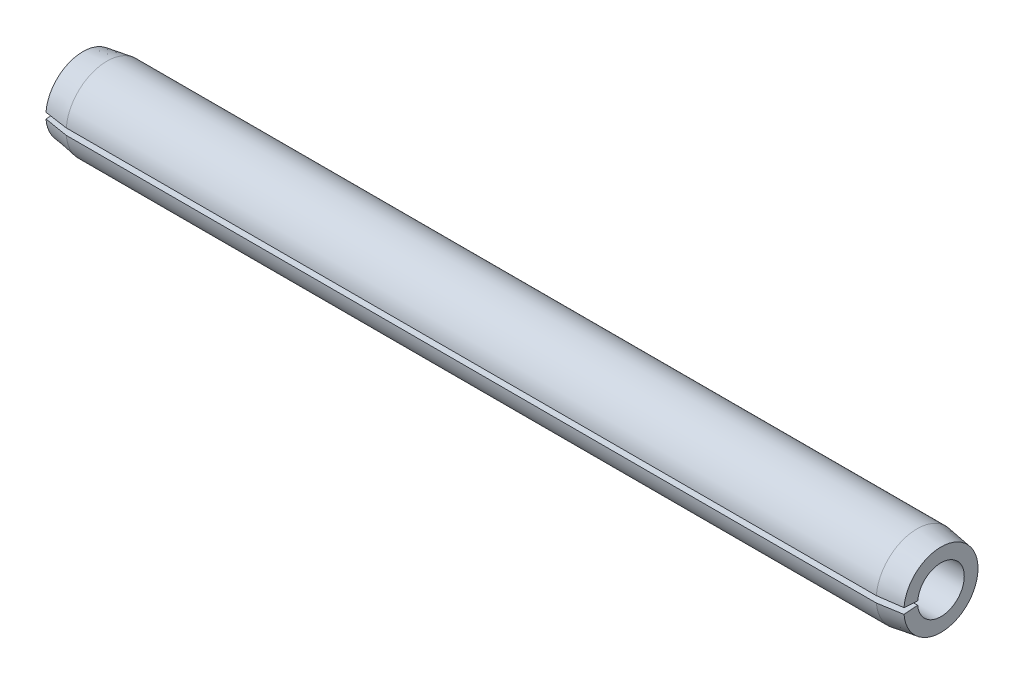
SolidWorks part; units mm, degrees
ref_plane "Plane1" through (0, 0, 0) normal (0, 0, 1) x (1, 0, 0)
ref_plane "Plane2" through (0, 0, 0) normal (0, 1, 0) x (1, 0, 0)
ref_plane "Plane3" through (0, 0, 0) normal (1, 0, 0) x (0, 0, -1)
sketch "Sketch1" plane through (0, 0, 0) normal (0, 0, 1) x (1, 0, 0)
  line L0 (-9.525, 0) -> (111.125, 0) construction
  line L1 (0, 1.3589) -> (50, 1.3589)
  line L2 (50, 1.3589) -> (50, 2.159)
  line L3 (50, 2.159) -> (48.603, 2.3749)
  line L4 (48.603, 2.3749) -> (1.397, 2.3749)
  line L5 (1.397, 2.3749) -> (0, 2.159)
  line L7 (0, 2.159) -> (0, 1.3589)
  dimension "Diameter" = 4.7498
  dimension "Length" = 50
  dimension "Thickness" = 1.016
  dimension "Top_ch_len" = 1.397
  dimension "Bottom_ch_len" = 1.397
  dimension "Bottom_ch_dia" = 4.318
  dimension "Top_ch_dia" = 4.318
revolve "Base-Revolve" add sketch "Sketch1" angle 360 about L0
sketch "Sketch2" plane through (0, 0, 0) normal (-1, 0, 0) x (0, -1, 0)
  line L0 (0, 0) -> (0.1901, 2.4149)
  line L1 (0, -3.175) -> (0, 12.7) construction
  line L2 (0, 0) -> (-0.1901, 2.4149)
  arc A0 (0.1901, 2.4149) -> (-0.1901, 2.4149) centre (0, 0) ccw
  dimension "D1" = 2.4224
  dimension "Gap_ang" = 9
extrude "Gap" cut sketch "Sketch2" against normal through all
equation "\"D1@Sketch2\" = \"Diameter@Sketch1\" * 0.51"
equation "' \"Bottom_ch_dia@Sketch1\" = \"Diameter@Sketch1\" -  ( \"Thickness@Sketch1\" / 2 ) "
equation "' \"Top_ch_dia@Sketch1\" = \"Bottom_ch_dia@Sketch1\""
equation "' \"Top_ch_len@Sketch1\" = \"Bottom_ch_len@Sketch1\""
